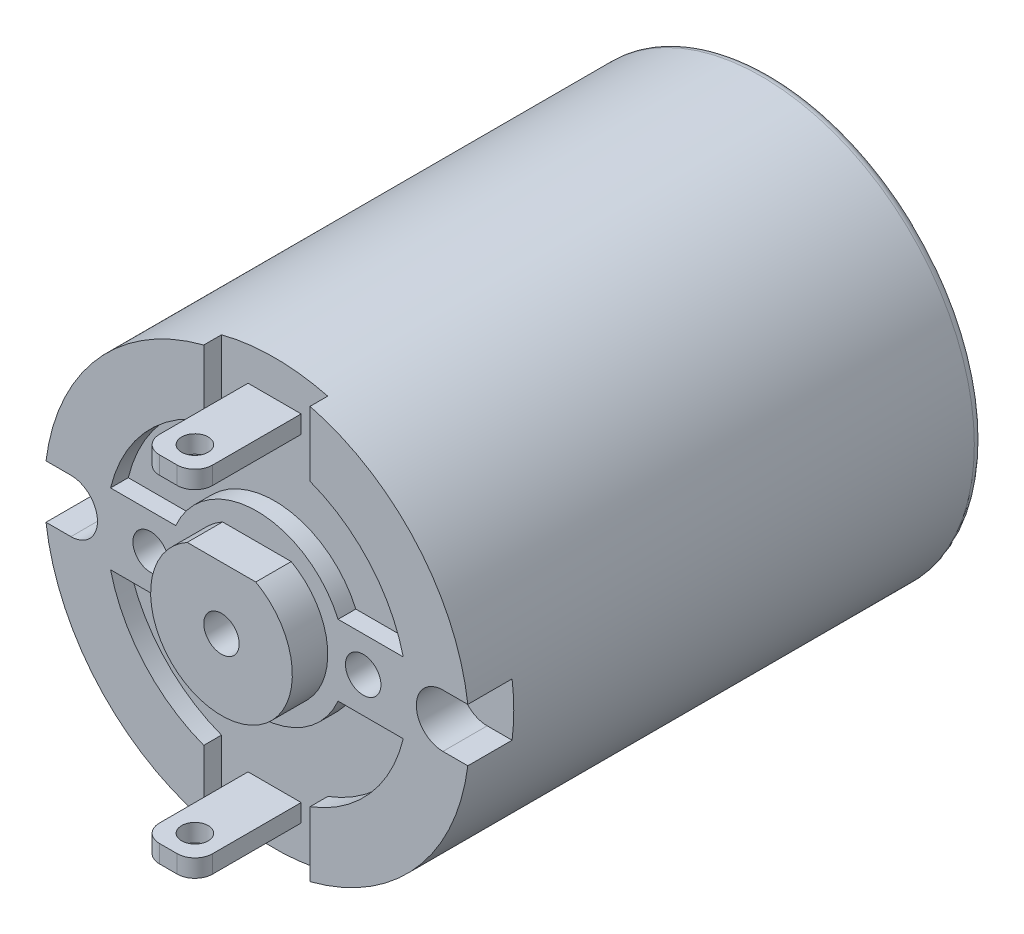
SolidWorks part; units mm, degrees
ref_plane "Plan1" through (0, 0, 0) normal (0, 0, 1) x (1, 0, 0)
ref_plane "Plan2" through (0, 0, 0) normal (0, 1, 0) x (1, 0, 0)
ref_plane "Plan3" through (0, 0, 0) normal (1, 0, 0) x (0, 0, -1)
sketch "Esquisse1" plane through (0, 0, 0) normal (0, 0, 1) x (1, 0, 0)
  circle A0 centre (0, 0) radius 12
  dimension "D1" = 24
extrude "Corps cylindrique" add sketch "Esquisse1" along normal blind 29
sketch "Esquisse3" plane through (0, 0, 0) normal (0, 0, -1) x (-1, 0, 0)
  circle A0 centre (0, 0) radius 1
  dimension "D1" = 2
sketch "Esquisse4" plane through (0, 0, 0) normal (0, 0, -1) x (-1, 0, 0)
  circle A0 centre (0, 0) radius 3
  dimension "D1" = 6
extrude "Bossage avant" add sketch "Esquisse4" along normal blind 2
sketch "Esquisse5" plane through (0, 0, 0) normal (0, 0, -1) x (-1, 0, 0)
  circle A0 centre (7, 0) radius 1
  circle A1 centre (0, 0) radius 12 construction
  circle A2 centre (-7, 0) radius 1
  dimension "D1" = 2
  dimension "D2" = 7
  dimension "D3" = 2
  dimension "D4" = 7
extrude "Taraudages fixation moteur" cut sketch "Esquisse5" against normal blind 2
fillet "Congé avant" radius 0.5 1 edges at (12, 0, 0)
extrude "Perçage axe moteur" cut sketch "Esquisse3" against normal through all and the other way blind 10
sketch "Esquisse7" plane through (0, 0, 0) normal (0, 0, -1) x (-1, 0, 0)
  line L1 (-2, 10) -> (2, 10)
  line L2 (-2, 10) -> (-2, 9)
  line L3 (-2, 9) -> (2, 9)
  line L4 (2, 10) -> (2, 9)
  line L5 (-2, -9) -> (2, -9)
  line L6 (-2, -9) -> (-2, -10)
  line L7 (-2, -10) -> (2, -10)
  line L8 (2, -9) -> (2, -10)
  circle A0 centre (0, 0) radius 11.5 construction
  dimension "D1" = 10
  dimension "D2" = 1
  dimension "D3" = 4
  dimension "D4" = 10
  dimension "D5" = 1
  dimension "D6" = 4
  dimension "D7" = 2
  dimension "D8" = 2
extrude "Emboutissages avant" cut sketch "Esquisse7" against normal blind 1
fillet "Congés emboutissages" radius 0.3 8 edges at (2, 9.5, 1) (-2, 9.5, 1) (2, 9.5, 0) (-2, 9.5, 0) (2, -9.5, 1) (-2, -9.5, 1) (2, -9.5, 0) (-2, -9.5, 0)
sketch "Esquisse9" plane through (0, 0, 29) normal (0, 0, 1) x (1, 0, 0)
  line L0 (4.5826, 2) -> (8.2614, 2)
  line L1 (-8.2614, 2) -> (-4.5826, 2)
  line L2 (4.5826, -2) -> (8.2614, -2)
  line L3 (-8.2614, -2) -> (-4.5826, -2)
  arc A0 (8.2614, 2) -> (-8.2614, 2) centre (0, 0) ccw
  arc A1 (-4.5826, -2) -> (4.5826, -2) centre (0, 0) ccw
  arc A2 (4.5826, 2) -> (-4.5826, 2) centre (0, 0) ccw
  arc A3 (-8.2614, -2) -> (8.2614, -2) centre (0, 0) ccw
  dimension "D1" = 17
  dimension "D2" = 10
  dimension "D4" = 2
extrude "Formes arrières" cut sketch "Esquisse9" against normal blind 1
sketch "Esquisse10" plane through (0, 0, 29) normal (0, 0, 1) x (1, 0, 0)
  circle A0 centre (0, 0) radius 4
  dimension "D1" = 8
extrude "Centreur" add sketch "Esquisse10" along normal blind 2
sketch "Esquisse11" plane through (0, 0, 29) normal (0, 0, 1) x (1, 0, 0)
  circle A0 centre (-6, 0) radius 1
  circle A1 centre (6, 0) radius 1
  circle A2 centre (0, 0) radius 12 construction
  dimension "D1" = 2
  dimension "D2" = 2
  dimension "D3" = 6
  dimension "D4" = 6
extrude "Perçages arrières" cut sketch "Esquisse11" against normal blind 4
sketch "Esquisse12" plane through (0, 0, 31) normal (0, 0, 1) x (1, 0, 0)
  circle A0 centre (0, 0) radius 1
  dimension "D1" = 2
extrude "Perçage central" cut sketch "Esquisse12" against normal through all
sketch "Esquisse13" plane through (0, 0, 31) normal (0, 0, 1) x (1, 0, 0)
  line L2 (-6, 6) -> (6, 6)
  line L3 (-6, 6) -> (-6, 3.5)
  line L4 (-6, 3.5) -> (6, 3.5)
  line L5 (6, 6) -> (6, 3.5)
  dimension "D1" = 3.5
  dimension "D2" = 6
extrude "Méplat arrière" cut sketch "Esquisse13" against normal blind 2
sketch "Esquisse14" plane through (0, 0, 29) normal (0, 0, 1) x (1, 0, 0)
  line L1 (-3, 18) -> (3, 18)
  line L2 (-3, 18) -> (-3, 7)
  line L3 (-3, 7) -> (3, 7)
  line L4 (3, 18) -> (3, 7)
  dimension "D1" = 6
  dimension "D2" = 3
  dimension "D3" = 7
extrude "Passages pattes électriques" cut sketch "Esquisse14" against normal up to surface (1 mm away)
sketch "Esquisse15" plane through (0, 0, 28) normal (0, 0, 1) x (1, 0, 0)
  line L1 (-1.5, 10) -> (1.5, 10)
  line L2 (-1.5, 10) -> (-1.5, 9)
  line L3 (-1.5, 9) -> (1.5, 9)
  line L4 (1.5, 10) -> (1.5, 9)
  dimension "D1" = 3
  dimension "D2" = 1.5
  dimension "D3" = 1
  dimension "D4" = 9
extrude "Patte électrique" add sketch "Esquisse15" along normal blind 6
fillet "Congés patte" radius 1 2 edges at (-1.5, 9.5, 34) (1.5, 9.5, 34)
sketch "Esquisse16" plane through (0, 9, 0) normal (0, -1, 0) x (1, 0, 0)
  line L0 (-1.5, 33) -> (-1.5, 28) construction
  line L1 (4, 31) -> (-4, 31) construction
  circle A0 centre (0, 32.5) radius 0.75
  dimension "D1" = 1.5
  dimension "D3" = 1.5
  dimension "D2" = 1.5
extrude "Perçage patte" cut sketch "Esquisse16" against normal through all
mirror "Symétrie patte électrique" about plane through (0, 0, 0) normal (0, 1, 0) of "Perçage patte", "Congés patte", "Patte électrique", "Passages pattes électriques"
sketch "Esquisse17" plane through (0, 0, 29) normal (0, 0, 1) x (1, 0, 0)
  line L1 (10.5, 1.5) -> (16, 1.5)
  line L3 (10.5, -1.5) -> (16, -1.5)
  line L4 (16, 1.5) -> (16, -1.5)
  arc A0 (10.5, 1.5) -> (10.5, -1.5) centre (10.5, 0) ccw
  dimension "D1" = 10.5
  dimension "D2" = 3
  dimension "D3" = 1.5
  dimension "D4" = 3
extrude "Encoche" cut sketch "Esquisse17" against normal blind 2.5
mirror "Symétrie encoche" about plane through (0, 0, 0) normal (1, 0, 0) of "Encoche"
